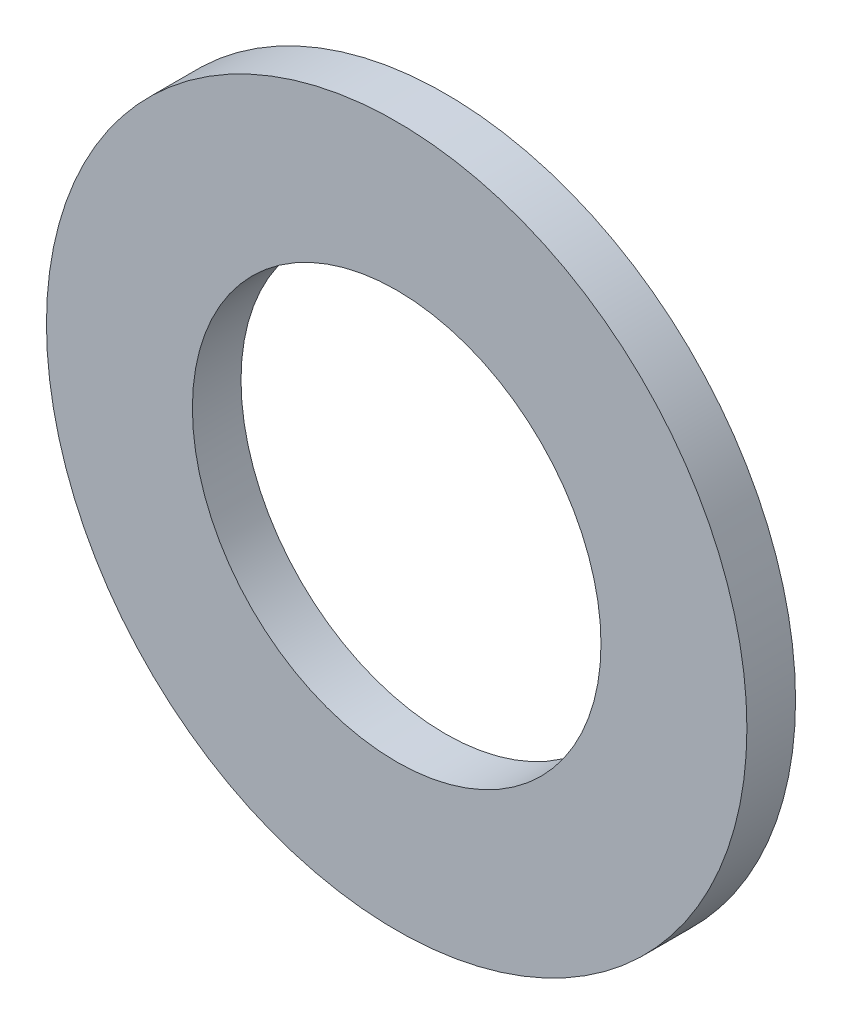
SolidWorks part; units mm, degrees
ref_plane "Plan de face" through (0, 0, 0) normal (0, 0, 1) x (1, 0, 0)
ref_plane "Plan de dessus" through (0, 0, 0) normal (0, 1, 0) x (1, 0, 0)
ref_plane "Plan de droite" through (0, 0, 0) normal (1, 0, 0) x (0, 0, -1)
sketch "Esquisse1" plane through (0, 0, 0) normal (0, 0, 1) x (1, 0, 0)
  circle A0 centre (0, 0) radius 18
  circle A1 centre (0, 0) radius 10.5
  dimension "D1" = 21
  dimension "D2" = 36
extrude "Extrusion1" add sketch "Esquisse1" along normal blind 2.5
